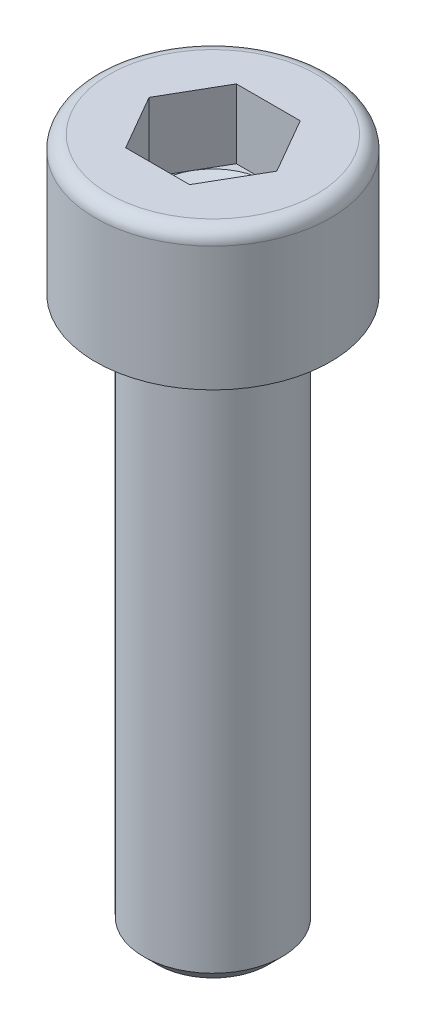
SolidWorks part; units mm, degrees
ref_plane "Face" through (0, 0, 0) normal (0, 0, 1) x (1, 0, 0)
ref_plane "Dessus" through (0, 0, 0) normal (0, 1, 0) x (1, 0, 0)
ref_plane "Droite" through (0, 0, 0) normal (1, 0, 0) x (0, 0, -1)
sketch "E_corps" plane through (0, 0, 0) normal (0, 0, 1) x (1, 0, 0)
  line L0 (0, 65.1173) -> (0, -25) construction
  line L1 (2.5, -5) -> (4.25, -5)
  line L2 (4.25, -5) -> (4.25, -0.5)
  line L3 (2.5, -5) -> (2.5, -24.5)
  line L4 (2, -25) -> (0, -25)
  line L5 (0, -25) -> (0, 0)
  line L6 (2, -25) -> (2.5, -24.5)
  line L8 (3.75, 0) -> (0, 0)
  line L9 (50, 0) -> (-50, 0) construction
  arc A0 (4.25, -0.5) -> (3.75, 0) centre (3.75, -0.5) ccw
revolve "corps" add sketch "E_corps" angle 360 about L0
sketch "Hexagone1" plane through (6.823, 0, -4.3971) normal (0, 1, 0) x (-1, 0, 0)
  line L0 (5.6683, 6.3971) -> (7.9777, 6.3971)
  line L1 (7.9777, 6.3971) -> (9.1324, 4.3971)
  line L2 (9.1324, 4.3971) -> (7.9777, 2.3971)
  line L3 (7.9777, 2.3971) -> (5.6683, 2.3971)
  line L4 (5.6683, 2.3971) -> (4.5136, 4.3971)
  line L5 (4.5136, 4.3971) -> (5.6683, 6.3971)
  circle A0 centre (6.823, 4.3971) radius 2 construction
  dimension "Diamètre" = 4
extrude "Enlèv. mat.-Extru.1" cut sketch "Hexagone1" against normal blind 2.5
sketch "Esquisse2" plane through (0, -2.5, 0) normal (0, 1, 0) x (-1, 0, 0)
  line L0 (1.1547, -2) -> (2.3094, 0) construction
  circle A0 centre (0, 0) radius 2
extrude "Enlèv. mat.-Extru.2" cut sketch "Esquisse2" against normal blind 2.5 draft 70
equation "\"Rayon_tête_de_vis@E_corps\" = 0.1*\"Diamètre_nominal@E_corps\""
equation "\"Hauteur_de_tête@E_corps\" = \"Diamètre_nominal@E_corps\""
